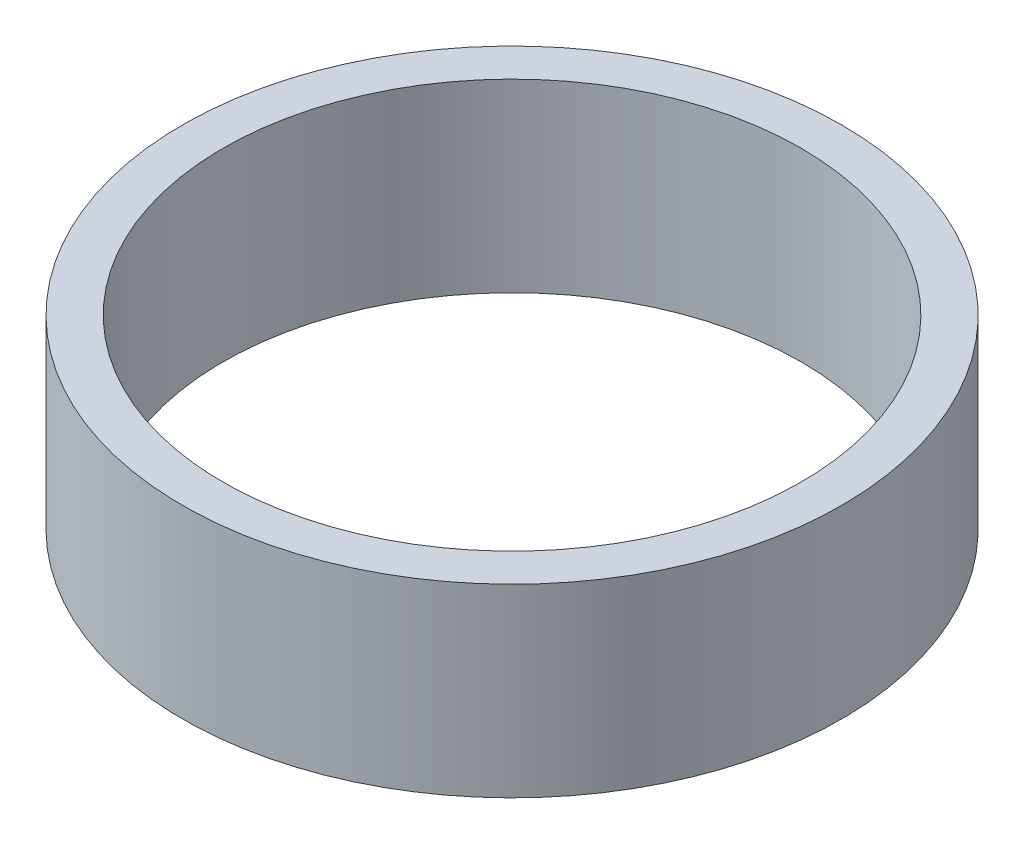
SolidWorks part; units mm, degrees
ref_plane "Face" through (0, 0, 0) normal (0, 0, 1) x (1, 0, 0)
ref_plane "Dessus" through (0, 0, 0) normal (0, 1, 0) x (1, 0, 0)
ref_plane "Droite" through (0, 0, 0) normal (1, 0, 0) x (0, 0, -1)
sketch "Esquisse1" plane through (0, 0, 0) normal (0, 0, 1) x (1, 0, 0)
  line L0 (0, 0) -> (0, 33.2168) construction
  line L2 (12.5, 0) -> (14.25, 0)
  line L3 (12.5, 0) -> (12.5, 8)
  line L4 (12.5, 8) -> (14.25, 8)
  line L5 (14.25, 0) -> (14.25, 8)
  dimension "D1" = 8
  dimension "D2" = 25
  dimension "D3" = 28.5
revolve "Révolution1" add sketch "Esquisse1" angle 360 about L0
